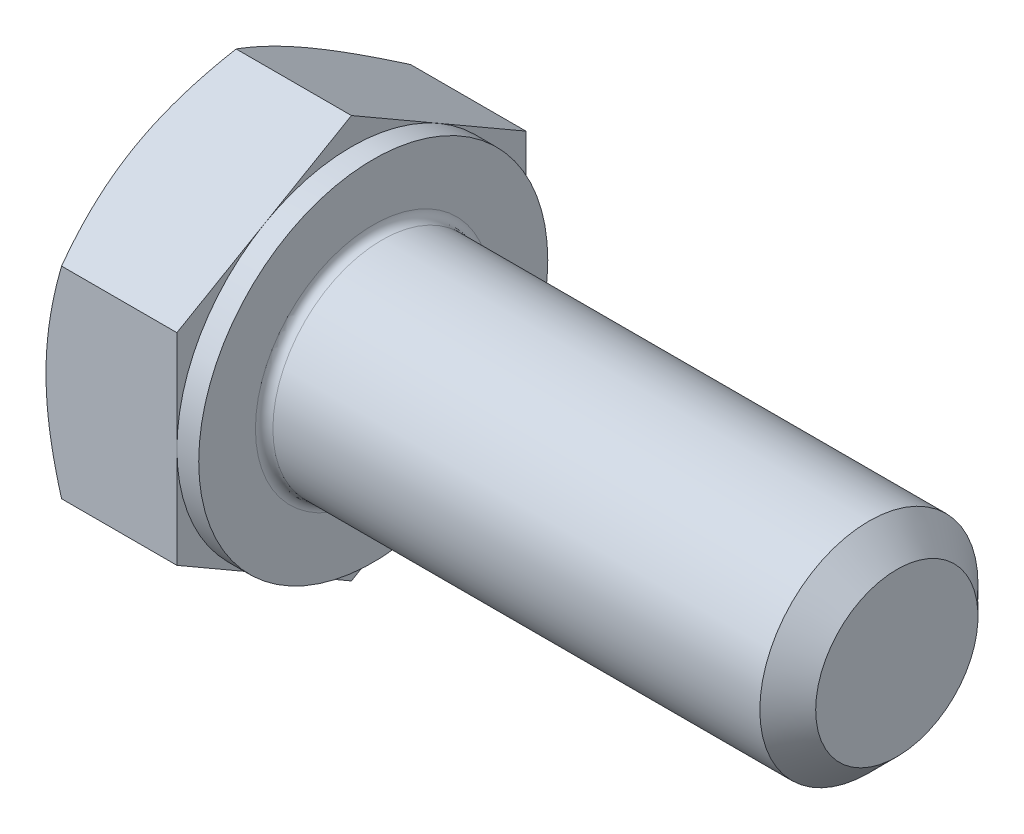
SolidWorks part; units mm, degrees
extrude "基体-拉伸" add sketch "草图1" along normal blind 3.5
sketch "草图1" plane through (0, 0, 0) normal (1, 0, 0) x (0, 0, -1)
  line L0 (4, 2.3094) -> (4, -2.3094)
  line L1 (-4, 2.3094) -> (-4, -2.3094)
  line L2 (4, -2.3094) -> (0, -4.6188)
  line L3 (0, -4.6188) -> (-4, -2.3094)
  line L4 (4, 2.3094) -> (0, 4.6188)
  line L5 (0, 4.6188) -> (-4, 2.3094)
revolve "切除-旋转1" cut sketch "草图3" angle 360 about L6
sketch "草图3" plane through (0, 0, 0) normal (0, 0, 1) x (1, 0, 0)
  line L0 (0, 4) -> (3.244, 9.6188)
  line L1 (0, 4.6188) -> (0, 2.3094) construction
  line L2 (3.244, 9.6188) -> (3.244, 14.6188)
  line L3 (3.244, 14.6188) -> (-10, 14.6188)
  line L4 (-10, 14.6188) -> (-10, 4)
  line L5 (-10, 4) -> (0, 4)
  line L6 (0, 0) -> (99.06, 0) construction
  line L7 (3.5, 4.6188) -> (0, 4.6188) construction
revolve "凸台-旋转1" add sketch "草图2" angle 360 about L7
sketch "草图2" plane through (0, 0, 0) normal (0, 0, 1) x (1, 0, 0)
  line L0 (0, 2.3094) -> (0, -2.3094) construction
  line L1 (0, 0) -> (15.5, 0)
  line L2 (0, 0) -> (0, 2.5)
  line L3 (0, 2.5) -> (15.5, 2.5)
  line L4 (15.5, 0) -> (15.5, 1.8072)
  line L5 (3.5, 4.6188) -> (3.5, 2.3094) construction
  line L7 (0, 0) -> (96.52, 0) construction
  line L8 (15.5, -1.8072) -> (90.335, -2.5) construction
  line L9 (0, -2.5) -> (90.335, -2.5) construction
  line L10 (4.3, 15.24) -> (4.3, -1.27) construction
  line L11 (3.5, 15.24) -> (3.5, -1.27) construction
  line L12 (3.5, 2.3094) -> (3.5, -2.3094) construction
  line L14 (15.5, 2.5) -> (15.5, 1.8072)
  dimension "l" = 12
  dimension "m" = 5
  dimension "Minor_dia" = 3.6144
  dimension "p" = 0.8
  dimension "h" = 12
ref_plane "前视" through (0, 0, 0) normal (0, 0, 1) x (1, 0, 0)
ref_plane "上视" through (0, 0, 0) normal (0, 1, 0) x (1, 0, 0)
ref_plane "右视" through (0, 0, 0) normal (1, 0, 0) x (0, 0, -1)
sketch "草图5" plane through (0, 0, 0) normal (0, 0, 1) x (1, 0, 0)
  line L0 (3.5, 4) -> (0.256, 9.6188)
  line L1 (3.5, 4.6188) -> (3.5, 2.3094) construction
  line L2 (0.256, 9.6188) -> (0.256, 14.6188)
  line L3 (0.256, 14.6188) -> (10.256, 14.6188)
  line L4 (10.256, 14.6188) -> (10.256, 4)
  line L5 (10.256, 4) -> (3.5, 4)
  line L7 (3.5, 4.6188) -> (0.3573, 4.6188) construction
  line L8 (0, 0) -> (99.06, 0) construction
  line L9 (0, 0) -> (99.06, 0) construction
revolve "切除-旋转2" cut sketch "草图5" angle 360 about L8
sketch "草图4" plane through (0, 0, 0) normal (0, 0, 1) x (1, 0, 0)
  line L1 (3.5, 4.6188) -> (3.5, 2.3094) construction
  line L2 (3.5, 4) -> (3, 4)
  line L3 (3.5, 4) -> (3.5, 14.6188)
  line L4 (3.5, 14.6188) -> (3, 14.6188)
  line L5 (0, 0) -> (95.25, 0) construction
  line L6 (0, 0) -> (96.52, 0) construction
  line L7 (3, 4) -> (3, 14.6188)
  line L8 (3.1427, 4.6188) -> (0.3573, 4.6188) construction
revolve "切除-旋转3" cut sketch "草图4" angle 360 about L5
chamfer "倒角" distance 0.64 angle 45 1 edges at (15.5, 0, 2.5)
fillet "圆角" radius 0.2 1 edges at (3.5, 0, -2.5)
sketch "草图6" plane through (0, 0, 0) normal (0, 0, 1) x (1, 0, 0)
  line L0 (4.1, -1.8072) -> (3.7, -2.5)
  line L1 (4.1, -1.8072) -> (4.5, -2.5)
  line L2 (4.5, -2.5) -> (4.5, -3.125)
  line L3 (-3.175, 0) -> (5.1513, 0) construction
  line L5 (4.5, -3.125) -> (3.7, -3.125)
  line L6 (3.7, -3.125) -> (3.7, -2.5)
  arc A0 (3.7, -2.5) -> (3.5, -2.7) centre (3.7, -2.7) ccw construction
revolve "切除-旋转4" [suppressed] cut sketch "草图6" angle 360 about L3
pattern_linear "阵列(线性)1" [suppressed]
equation "\"D3@草图1\" = \"s@草图1\" / 2"
equation "\"D4@草图1\" = \"D3@草图1\""
equation "\"D5@草图1\" = \"D4@草图1\""
equation "\"D1@草图3\" = \"s@草图1\" / 2"
equation "\"D1@草图5\" = \"s@草图1\" / 2"
equation "\"Head_ch_ang@草图5\" = \"Head_ch_ang@草图3\""
equation "\"D1@草图4\" = \"s@草图1\""
equation "\"Diameter@草图6\" = \"m@草图2\""
equation "\"Overcut@草图6\" = \"m@草图2\" * 1.25"
equation "\"Minor_dia@草图2\" = \"m@草图2\"-\"p@草图2\" * 1.732"
equation "\"Thread_minor@螺旋线1\" = \"Minor_dia@草图2\""
equation "\"Thread_minor@草图6\" = \"Minor_dia@草图2\""
equation "\"D1@倒角\" = \"p@草图2\"*0.8"
equation "\"Thread_length@螺旋线1\" = \"l@草图2\" - \"p@草图2\""
equation "\"Num_threads@阵列(线性)1\" = \"l@草图2\" / \"p@草图2\""
